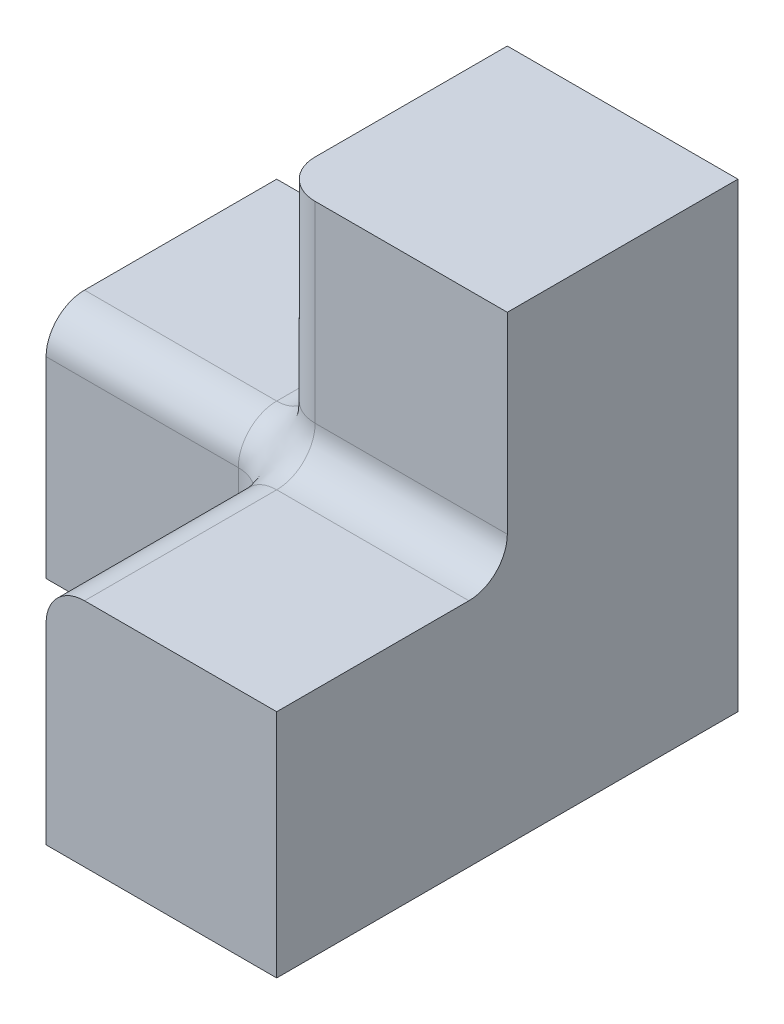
SolidWorks part; units mm, degrees
ref_plane "Front Plane" through (0, 0, 0) normal (0, 0, 1) x (1, 0, 0)
ref_plane "Top Plane" through (0, 0, 0) normal (0, 1, 0) x (1, 0, 0)
ref_plane "Right Plane" through (0, 0, 0) normal (1, 0, 0) x (0, 0, -1)
sketch "Sketch1" plane through (0, 0, 0) normal (0, 1, 0) x (1, 0, 0)
  line L0 (0, 0) -> (-152.4, 0)
  line L1 (-152.4, 0) -> (-152.4, -76.2)
  line L2 (-152.4, -76.2) -> (-76.2, -76.2)
  line L3 (-76.2, -76.2) -> (-76.2, -152.4)
  line L4 (-76.2, -152.4) -> (0, -152.4)
  line L5 (0, -152.4) -> (0, 0)
  line L6 (-76.2, -76.2) -> (-76.2, 0) construction
  line L7 (-76.2, -76.2) -> (0, -76.2) construction
  dimension "D1" = 152.4
extrude "Boss-Extrude1" add sketch "Sketch1" along normal blind 76.2
sketch "Sketch2" plane through (0, 76.2, 0) normal (0, 1, 0) x (1, 0, 0)
  line L1 (0, 0) -> (-76.2, 0)
  line L2 (0, 0) -> (0, -76.2)
  line L3 (0, -76.2) -> (-76.2, -76.2)
  line L4 (-76.2, 0) -> (-76.2, -76.2)
extrude "Boss-Extrude2" add sketch "Sketch2" along normal blind 76.2
fillet "Fillet1" radius 12.7 1 edges at (-76.2, 114.3, 76.2)
fillet "Fillet2" radius 12.7 1 edges at (-76.2, 38.1, 76.2)
fillet "Fillet3" radius 12.7 3 edges at (-72.4803, 76.2, 72.4803)
fillet "Fillet4" radius 12.7 4 edges at (-76.2, 76.2, 120.65) (-76.3414, 76.2, 87.0103) (-87.0103, 76.2, 76.3414) (-120.65, 76.2, 76.2)
sketch "Sketch3" plane through (-152.4, 0, 0) normal (-1, 0, 0) x (0, 0, 1)
  line L0 (88.9, 63.5) -> (76.2, 63.5)
other "DeleteFace1"
surface "Surface-Fill1"
